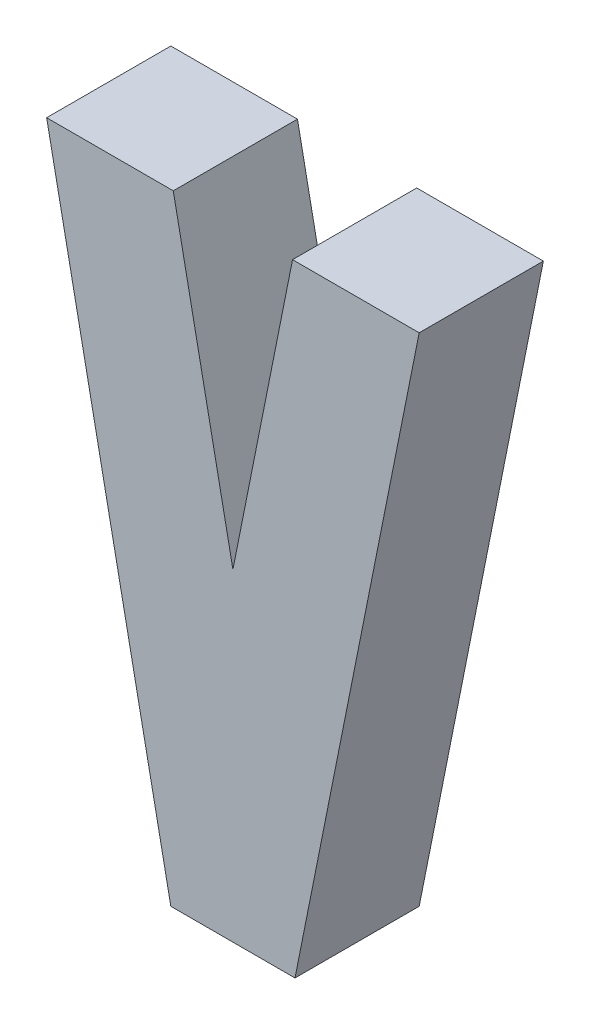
SolidWorks part; units mm, degrees
ref_plane "Plan de face" through (0, 0, 0) normal (0, 0, 1) x (1, 0, 0)
ref_plane "Plan de dessus" through (0, 0, 0) normal (0, 1, 0) x (1, 0, 0)
ref_plane "Plan de droite" through (0, 0, 0) normal (1, 0, 0) x (0, 0, -1)
sketch "Esquisse1" plane through (0, 0, 0) normal (0, 0, 1) x (1, 0, 0)
  line L0 (0, 50) -> (10, 0)
  line L1 (10, 0) -> (20, 0)
  line L3 (0, 50) -> (10.198, 50)
  line L5 (30, 50) -> (20, 0)
  line L6 (10.198, 50) -> (15, 25.9902)
  line L7 (19.802, 50) -> (15, 25.9902)
  line L8 (19.802, 50) -> (30, 50)
  dimension "D5" = 10
  dimension "D6" = 10
extrude "Boss.-Extru.1" add sketch "Esquisse1" along normal blind 10
